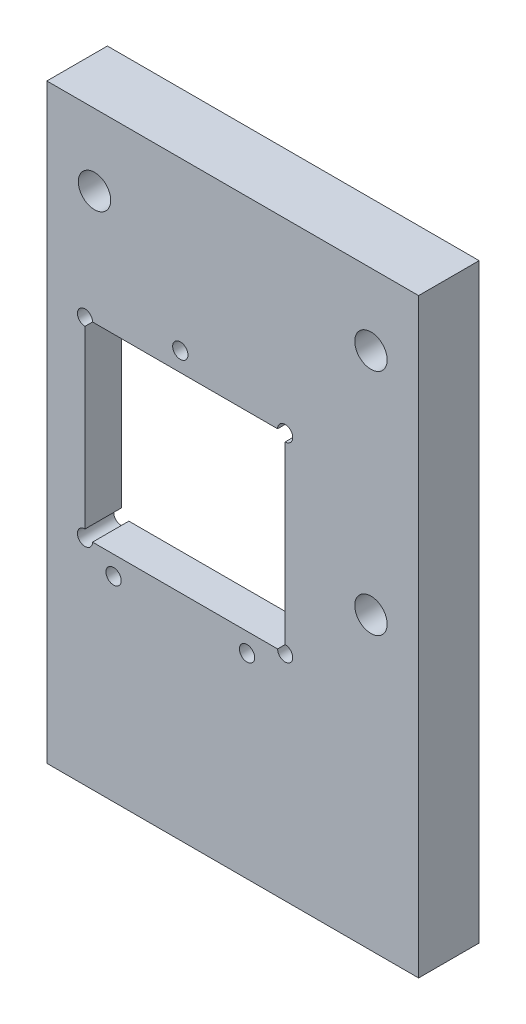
SolidWorks part; units mm, degrees
ref_plane "Front Plane" through (0, 0, 0) normal (0, 0, 1) x (1, 0, 0)
ref_plane "Top Plane" through (0, 0, 0) normal (0, 1, 0) x (1, 0, 0)
ref_plane "Right Plane" through (0, 0, 0) normal (1, 0, 0) x (0, 0, -1)
sketch "Sketch1" plane through (0, 0, 0) normal (0, 0, 1) x (1, 0, 0)
  line L1 (-19.5, -31) -> (19.5, -31)
  line L2 (-19.5, -31) -> (-19.5, 31)
  line L3 (-19.5, 31) -> (19.5, 31)
  line L4 (19.5, -31) -> (19.5, 31)
  line L5 (-19.5, -31) -> (19.5, 31) construction
  line L6 (-19.5, 31) -> (19.5, -31) construction
  point P0 (0, 0)
  dimension "D1" = 39
  dimension "D2" = 62
extrude "Boss-Extrude1" add sketch "Sketch1" along normal blind 6.35
hole_wizard "M2x0.4 Tapped Hole1" positions "3DSketch1" profile "Sketch2" tap size "M2x0.4" standard "ANSI Metric"
sketch3d "3DSketch1"
  line L0 (19.5, 31, 6.35) -> (-19.5, 31, 6.35) construction
  line L2 (-5.5, 13.5, 6.35) -> (-5.5, -26.5126, 6.35) construction
  line L4 (-12.5, -10.5, 6.35) -> (9.5433, -10.5, 6.35) construction
  line L7 (19.5, -31, 6.35) -> (19.5, 31, 6.35) construction
  point P0 (-5.5, 13.5, 6.35)
  point P2 (-12.5, -10.5, 6.35)
  point P4 (1.5, -10.5, 6.35)
  dimension "D1" = 17.5
  dimension "D2" = 25
  dimension "D3" = 24
  dimension "D4" = 14
  dimension "D5" = 7
sketch "Sketch2" plane through (-5.5, 13.5, 6.35) normal (1, 0, 0) x (0, -1, 0)
  line L0 (0, 0) -> (0, 6.35)
  line L1 (0, 6.35) -> (0.8, 6.35)
  line L2 (0.8, 6.35) -> (0.8, 0)
  line L5 (0.8, 0) -> (0, 0)
  line L11 (0, -6.35) -> (0, 107.95) construction
  dimension "Thru Tap Drill Dia." = 1.6
  dimension "Thru Tap Drill Depth" = 6.35
sketch "Sketch3" plane through (0, 0, 6.35) normal (0, 0, 1) x (1, 0, 0)
  line L1 (-15.5, 11.5) -> (5.5, 11.5)
  line L2 (-15.5, 11.5) -> (-15.5, -8.5)
  line L3 (-15.5, -8.5) -> (5.5, -8.5)
  line L4 (5.5, 11.5) -> (5.5, -8.5)
  circle A0 centre (-5.5, 13.5) radius 0.8 construction
  dimension "D3" = 2
  dimension "D4" = 10
  dimension "D1" = 20
  dimension "D2" = 21
extrude "Cut-Extrude1" cut sketch "Sketch3" against normal through all
hole_wizard "1/16 (0.0625) Dowel Hole1" positions "3DSketch3" profile "Sketch4" hole size "1/16" standard "ANSI Inch"
sketch3d "3DSketch3"
  point P0 (-15.5, 11.5, 6.35)
  point P2 (5.5, 11.5, 6.35)
  point P4 (5.5, -8.5, 6.35)
  point P6 (-15.5, -8.5, 6.35)
sketch "Sketch4" plane through (-15.5, 11.5, 6.35) normal (1, 0, 0) x (0, -1, 0)
  line L0 (0, 0) -> (0, 6.35)
  line L1 (0, 6.35) -> (0.7937, 6.35)
  line L2 (0.7937, 6.35) -> (0.7937, 0)
  line L5 (0.7937, 0) -> (0, 0)
  line L11 (0, -6.35) -> (0, 107.95) construction
  dimension "Thru Hole Dia." = 1.5875
  dimension "Thru Hole Depth" = 6.35
sketch "Sketch9" plane through (0, 0, 6.35) normal (0, 0, 1) x (1, 0, 0)
  line L0 (14.5, 10.4531) -> (14.5, -49989.5469) construction
  line L1 (-9.4283, 23.5) -> (49990.5717, 23.5) construction
  line L2 (4.7062, 11.5) -> (-14.7063, 11.5) construction
  line L4 (19.5, -31) -> (19.5, 31) construction
  line L5 (-19.5, 31) -> (-19.5, -31) construction
  circle A0 centre (14.5, -0.5) radius 1.7
  circle A1 centre (14.5, 23.5) radius 1.7
  circle A2 centre (-14.5, 23.5) radius 1.7
  dimension "D5" = 3.4
  dimension "D6" = 3.4
  dimension "D7" = 3.4
  dimension "D1" = 12
  dimension "D2" = 5
  dimension "D3" = 24
  dimension "D4" = 5
extrude "Cut-Extrude2" cut sketch "Sketch9" against normal through all
sketch "Sketch11" plane through (0, 0, 0) normal (0, 0, -1) x (-1, 0, 0)
  line L0 (-10.5, 17) -> (20.5, 17)
  line L1 (-10.5, 17) -> (-10.5, -14)
  line L2 (-10.5, -14) -> (20.5, -14)
  line L3 (20.5, 17) -> (20.5, -14)
  line L4 (15.5, 10.7062) -> (15.5, -7.7063) construction
  line L5 (-5.5, -7.7063) -> (-5.5, 10.7062) construction
  line L6 (-4.7062, 11.5) -> (14.7063, 11.5) construction
  line L7 (14.7063, -8.5) -> (-4.7062, -8.5) construction
  dimension "D1" = 5
  dimension "D2" = 5
  dimension "D3" = 5.5
  dimension "D4" = 5.5
extrude "Cut-Extrude3" cut sketch "Sketch11" against normal blind 2.54
fillet "Fillet1" radius 1 2 edges at (10.5, -14, 1.27) (10.5, 17, 1.27)
hole_wizard "1/8 (0.1250) Dowel Hole2" positions "3DSketch5" profile "Sketch13" hole size "1/8" standard "ANSI Inch"
sketch3d "3DSketch5"
  line L0 (-19.5, -31, 6.35) -> (-19.5, -31, 0) construction
  line L1 (19.5, -31, 6.35) -> (19.5, -31, 0) construction
  line L2 (-19.5, -31, 6.35) -> (19.5, -31, 6.35) construction
  point P0 (-6.8, -31, 3.175)
  point P2 (6.8, -31, 3.175)
  dimension "D1" = 12.7
  dimension "D2" = 12.7
  dimension "D3" = 3.175
  dimension "D4" = 3.175
sketch "Sketch13" plane through (-6.8, -31, 3.175) normal (1, 0, 0) x (0, 0, -1)
  line L0 (0, 0) -> (0, 7.3039)
  line L1 (0, 7.3039) -> (1.5875, 6.35)
  line L2 (1.5875, 6.35) -> (1.5875, 0)
  line L5 (1.5875, 0) -> (0, 0)
  line L10 (0, 7.3039) -> (-1.5875, 6.35) construction
  line L11 (0, -6.35) -> (0, 107.95) construction
  dimension "Hole Dia." = 3.175
  dimension "Hole Depth" = 6.35
  dimension "Drill Angle" = 118
hole_wizard "Tap Drill for #4-40 Tap1" positions "3DSketch4" profile "Sketch12" hole size "#4-40" standard "ANSI Inch"
sketch3d "3DSketch4"
  line L0 (-19.5, -31, 6.35) -> (19.5, -31, 6.35) construction
  line L1 (-19.5, -31, 6.35) -> (-19.5, -31, 0) construction
  line L2 (19.5, -31, 6.35) -> (19.5, -31, 0) construction
  point P0 (-13.15, -31, 3.175)
  point P2 (13.15, -31, 3.175)
  dimension "D1" = 3.175
  dimension "D2" = 3.175
  dimension "D3" = 6.35
  dimension "D4" = 6.35
sketch "Sketch12" plane through (-13.15, -31, 3.175) normal (1, 0, 0) x (0, 0, -1)
  line L0 (0, 0) -> (0, 13.3792)
  line L1 (0, 13.3792) -> (1.1303, 12.7)
  line L2 (1.1303, 12.7) -> (1.1303, 0)
  line L5 (1.1303, 0) -> (0, 0)
  line L10 (0, 13.3792) -> (-1.1303, 12.7) construction
  line L11 (0, -6.35) -> (0, 107.95) construction
  dimension "Hole Dia." = 2.2606
  dimension "Hole Depth" = 12.7
  dimension "Drill Angle" = 118
